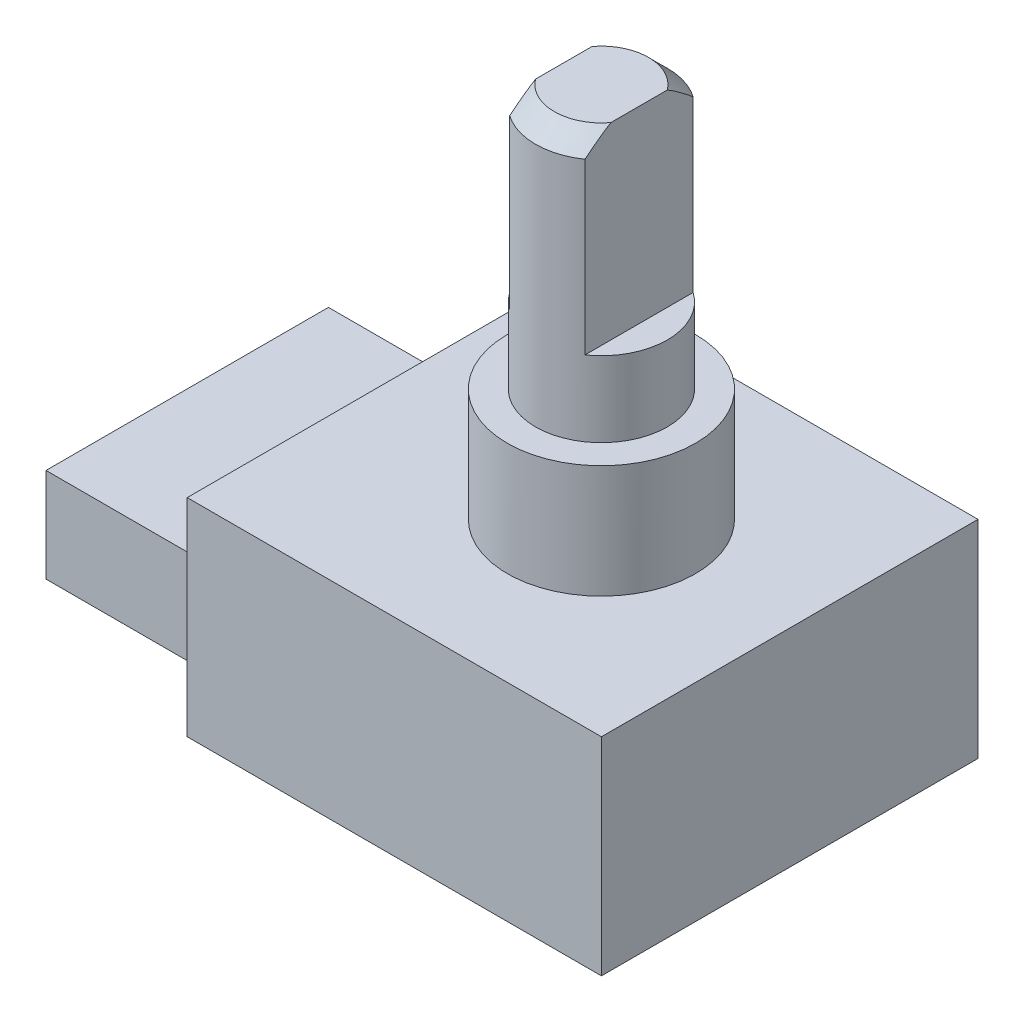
SolidWorks part; units mm, degrees
ref_plane "Přední rovina" through (0, 0, 0) normal (0, 0, 1) x (1, 0, 0)
ref_plane "Horní rovina" through (0, 0, 0) normal (0, 1, 0) x (1, 0, 0)
ref_plane "Pravá rovina" through (0, 0, 0) normal (1, 0, 0) x (0, 0, -1)
sketch "Skica1" plane through (0, 0, 0) normal (0, 1, 0) x (1, 0, 0)
  circle A0 centre (0, 0) radius 2.5
  dimension "D1" = 5
extrude "Přidat vysunutím1" add sketch "Skica1" along normal blind 3
sketch "Skica2" plane through (0, 3, 0) normal (0, 1, 0) x (1, 0, 0)
  circle A0 centre (0, 0) radius 1.75
  dimension "D1" = 3.5
extrude "Přidat vysunutím2" add sketch "Skica2" along normal blind 7
chamfer "Zkosení1" distance 0.5 angle 45 1 edges at (0, 10, 1.75)
sketch "Skica4" plane through (0, 0, 0) normal (0, 0, 1) x (1, 0, 0)
  line L0 (0, 11.881) -> (0, -2.7575) construction
  line L1 (1, 10) -> (1, 5)
  line L2 (1.25, 10) -> (-1.25, 10) construction
  line L3 (1, 5) -> (1.75, 5)
  line L4 (1.75, 5) -> (1.75, 10)
  line L5 (1.75, 10) -> (1, 10)
  line L6 (-1.75, 10) -> (-1, 10)
  line L7 (-1.75, 5) -> (-1.75, 10)
  line L8 (-1, 5) -> (-1.75, 5)
  line L9 (-1, 10) -> (-1, 5)
  line L10 (1.75, 3) -> (1.75, 9.5) construction
  dimension "D1" = 2
  dimension "D2" = 5
extrude "Odebrat vysunutím1" cut sketch "Skica4" against normal through all both and the other way through all
sketch "Skica5" plane through (0, 0, 0) normal (0, 1, 0) x (1, 0, 0)
  line L0 (-6.6163, 0) -> (5.2278, 0) construction
  line L2 (-6, -5) -> (5, -5)
  line L3 (-6, -5) -> (-6, 5)
  line L4 (-6, 5) -> (5, 5)
  line L5 (5, -5) -> (5, 5)
  line L6 (-6, -5) -> (5, 5) construction
  line L7 (-6, 5) -> (5, -5) construction
  point P3 (-0.5, 0)
  dimension "D1" = 10
  dimension "D2" = 11
  dimension "D3" = 5
extrude "Přidat vysunutím3" add sketch "Skica5" against normal blind 5.5
sketch "Skica6" plane through (-6, 0, 0) normal (-1, 0, 0) x (0, 0, 1)
  line L0 (-5, -5.5) -> (5, -5.5) construction
  line L1 (-3.75, -5) -> (3.75, -5)
  line L2 (-3.75, -5) -> (-3.75, -2.5)
  line L3 (-3.75, -2.5) -> (3.75, -2.5)
  line L4 (3.75, -5) -> (3.75, -2.5)
  line L5 (-3.75, -5) -> (3.75, -2.5) construction
  line L6 (-3.75, -2.5) -> (3.75, -5) construction
  point P0 (0, -3.75)
  dimension "D1" = 2.5
  dimension "D2" = 7.5
  dimension "D3" = 0.5
extrude "Přidat vysunutím4" add sketch "Skica6" along normal blind 5
